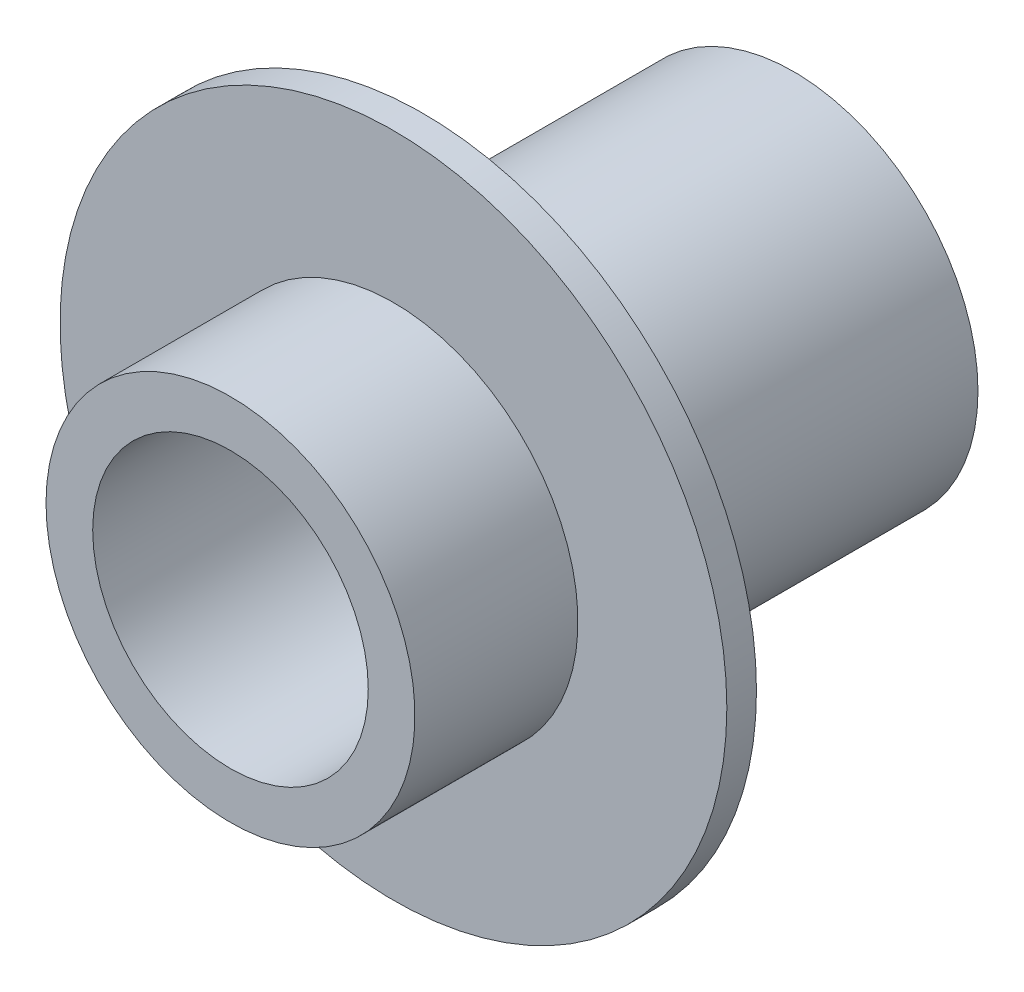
SolidWorks part; units mm, degrees
ref_plane "Front" through (0, 0, 0) normal (0, 0, 1) x (1, 0, 0)
ref_plane "Top" through (0, 0, 0) normal (0, 1, 0) x (1, 0, 0)
ref_plane "Right" through (0, 0, 0) normal (1, 0, 0) x (0, 0, -1)
sketch "Sketch1" plane through (0, 0, 0) normal (0, 0, 1) x (1, 0, 0)
  circle A0 centre (0, 0) radius 2.3622
  circle A1 centre (0, 0) radius 3.1623
  dimension "D1" = 4.7244
  dimension "D2" = 6.3246
extrude "Base-Extrude" add sketch "Sketch1" along normal blind 6.35
sketch "Sketch2" plane through (0, 0, 6.35) normal (0, 0, 1) x (1, 0, 0)
  circle A0 centre (0, 0) radius 5.715
  circle A1 centre (0, 0) radius 2.3622 construction
  circle A2 centre (0, 0) radius 2.3622
  dimension "D1" = 11.43
extrude "Boss-Extrude1" add sketch "Sketch2" along normal blind 0.508
sketch "Sketch3" plane through (0, 0, 6.35) normal (0, 0, -1) x (-1, 0, 0)
  circle A0 centre (0, 0) radius 3.1623 construction
  circle A1 centre (0, 0) radius 3.1623
  circle A2 centre (0, 0) radius 2.3622 construction
  circle A3 centre (0, 0) radius 2.3622
extrude "Boss-Extrude2" add sketch "Sketch3" against normal blind 3.302
